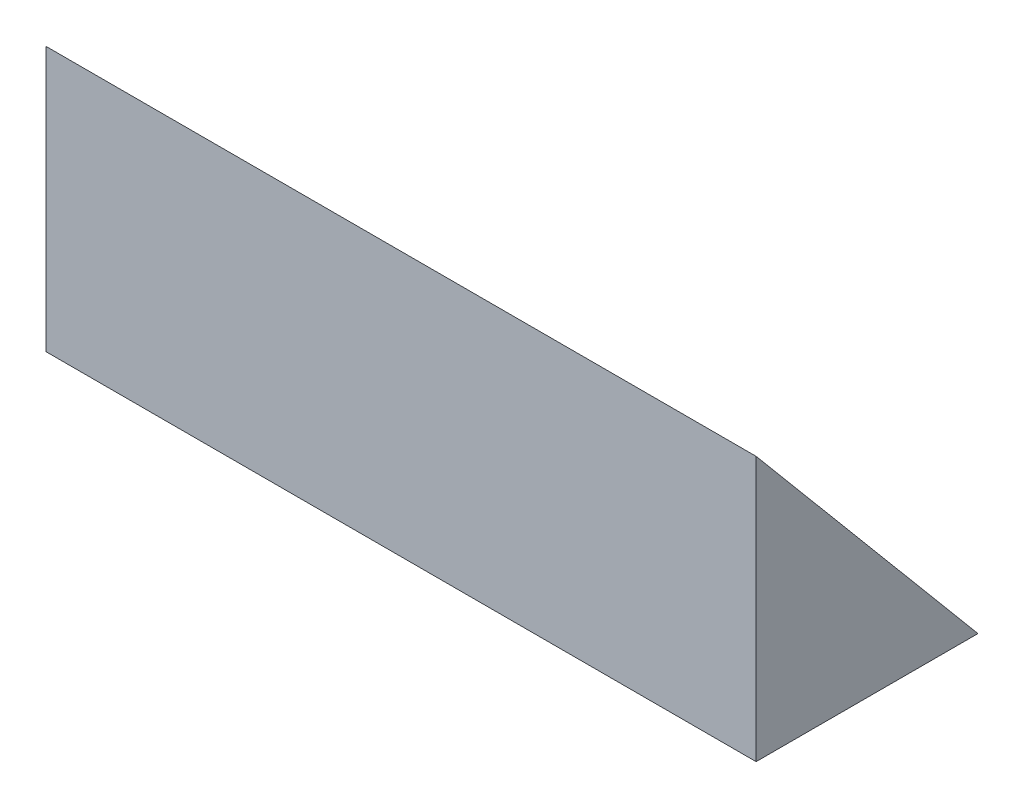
SolidWorks part; units mm, degrees
ref_plane "Plan de face" through (0, 0, 0) normal (0, 0, 1) x (1, 0, 0)
ref_plane "Plan de dessus" through (0, 0, 0) normal (0, 1, 0) x (1, 0, 0)
ref_plane "Plan de droite" through (0, 0, 0) normal (1, 0, 0) x (0, 0, -1)
sketch "Esquisse1" plane through (0, 0, 0) normal (1, 0, 0) x (0, 0, -1)
  line L0 (0, 0) -> (500, 0)
  line L1 (500, 0) -> (0, 595.8768)
  line L2 (0, 0) -> (0, 595.8768)
  dimension "D1" = 50
  dimension "D2" = 500
extrude "Boss.-Extru.1" add sketch "Esquisse1" along normal blind 1600
sketch "Esquisse2" plane through (0, 0, 0) normal (0, -1, 0) x (1, 0, 0)
  line L0 (800, -500) -> (800, 0) construction
  line L1 (1600, -500) -> (0, -500) construction
  line L2 (1600, 0) -> (0, 0) construction
  line L3 (800, -250) -> (258.9561, -250) construction
  circle A0 centre (550, -250) radius 5
  circle A1 centre (1050, -250) radius 5
  dimension "D1" = 250
extrude "Enlèv. mat.-Extru.1" cut sketch "Esquisse2" against normal blind 10
